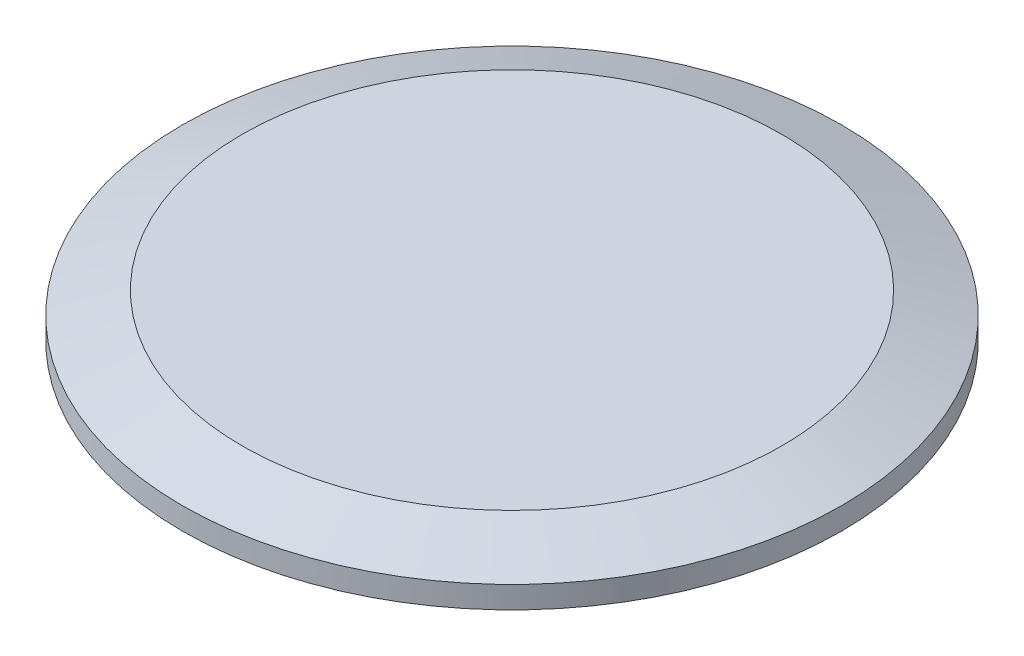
SolidWorks part; units mm, degrees
ref_plane "Front Plane" through (0, 0, 0) normal (0, 0, 1) x (1, 0, 0)
ref_plane "Top Plane" through (0, 0, 0) normal (0, 1, 0) x (1, 0, 0)
ref_plane "Right Plane" through (0, 0, 0) normal (1, 0, 0) x (0, 0, -1)
sketch "Sketch1" plane through (0, 0, 0) normal (0, 0, 1) x (1, 0, 0)
  line L0 (0, 0) -> (-76.3632, 0)
  line L1 (-83.439, 0) -> (-83.439, 5.588)
  line L2 (-83.439, 5.588) -> (-68.2955, 11.0998)
  line L3 (-68.2955, 11.0998) -> (0, 11.0998)
  line L4 (0, 11.0998) -> (0, 0) construction
  line L5 (-79.9992, 0) -> (-83.439, 0)
  line L6 (0, 0) -> (0, 11.0998)
  arc A0 (-77.0857, 0.4745) -> (-79.2767, 0.4745) centre (-78.1812, 0) ccw
  arc A1 (-76.3632, 0) -> (-77.0857, 0.4745) centre (-76.3632, 0.7874) cw
  arc A2 (-79.9992, 0) -> (-79.2767, 0.4745) centre (-79.9992, 0.7874) ccw
  point P13 (-79.375, 0)
  dimension "D1" = 2.3876
  dimension "D2" = 0.7874
  dimension "D3" = 83.439
  dimension "D4" = 78.1812
  dimension "D5" = 5.588
  dimension "D6" = 20
  dimension "D7" = 11.0998
revolve "Revolve1" add sketch "Sketch1" angle 360 about L4
